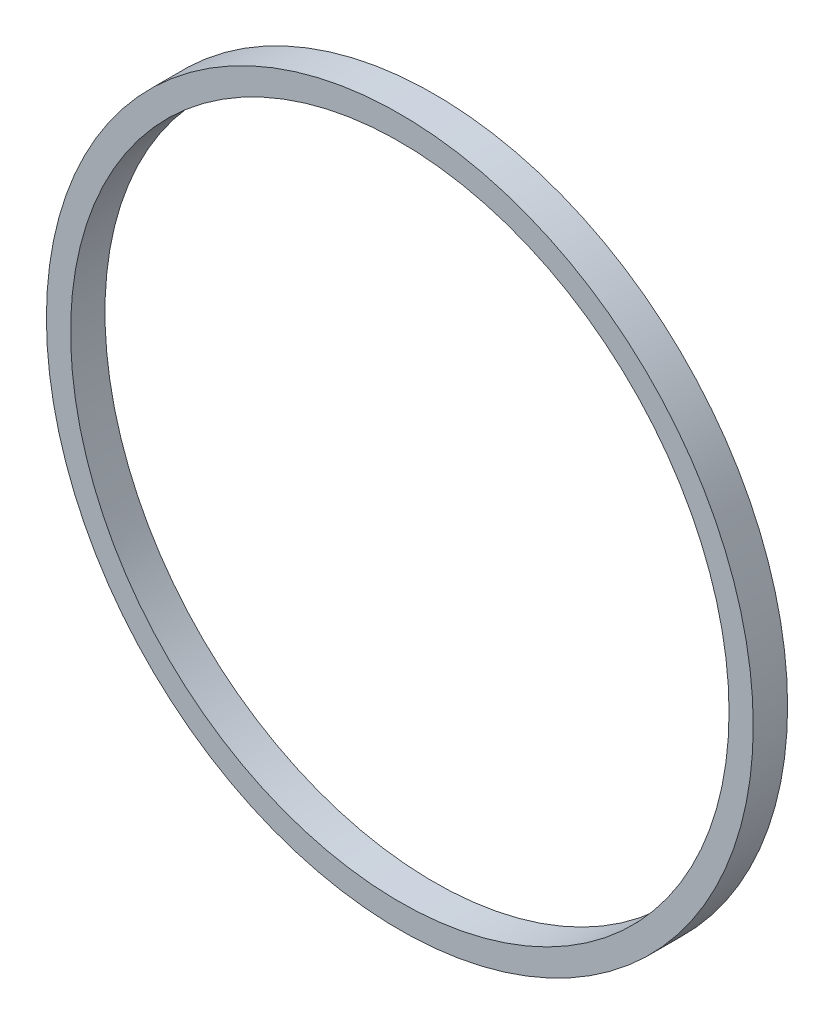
SolidWorks part; units mm, degrees
ref_plane "Front Plane" through (0, 0, 0) normal (0, 0, 1) x (1, 0, 0)
ref_plane "Top Plane" through (0, 0, 0) normal (0, 1, 0) x (1, 0, 0)
ref_plane "Right Plane" through (0, 0, 0) normal (1, 0, 0) x (0, 0, -1)
sketch "Sketch2" plane through (0, 0, 0) normal (0, 0, 1) x (1, 0, 0)
  circle A0 centre (0, 0) radius 11.5
  circle A1 centre (0, 0) radius 12.345
  dimension "D1" = 24.69
  dimension "D2" = 23
extrude "Boss-Extrude1" add sketch "Sketch2" along normal blind 1.2
